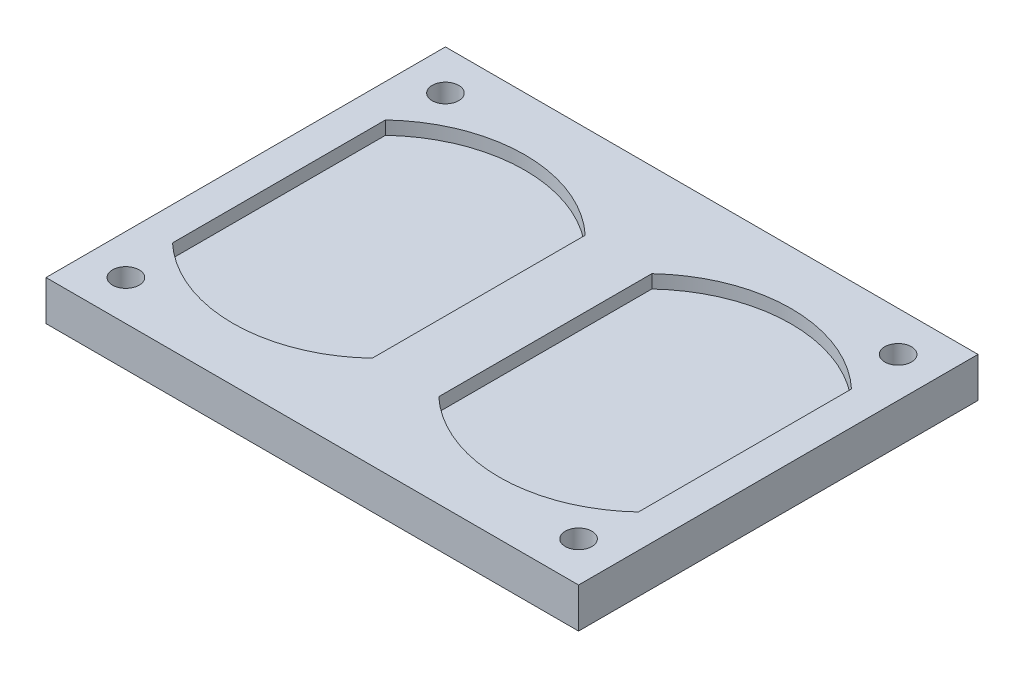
SolidWorks part; units mm, degrees
ref_plane "Front Plane" through (0, 0, 0) normal (0, 0, 1) x (1, 0, 0)
ref_plane "Top Plane" through (0, 0, 0) normal (0, 1, 0) x (1, 0, 0)
ref_plane "Right Plane" through (0, 0, 0) normal (1, 0, 0) x (0, 0, -1)
sketch "Sketch1" plane through (0, 0, 0) normal (0, 1, 0) x (1, 0, 0)
  line L1 (-100, -75) -> (100, -75)
  line L2 (-100, -75) -> (-100, 75)
  line L3 (-100, 75) -> (100, 75)
  line L4 (100, -75) -> (100, 75)
  line L5 (-100, -75) -> (100, 75) construction
  line L6 (-100, 75) -> (100, -75) construction
  point P0 (0, 0)
  dimension "D1" = 200
  dimension "D2" = 150
extrude "Boss-Extrude1" add sketch "Sketch1" along normal blind 15
sketch "Sketch2" plane through (0, 15, 0) normal (0, 1, 0) x (1, 0, 0)
  line L0 (0, -75) -> (0, 75) construction
  line L1 (-100, -75) -> (100, -75) construction
  line L2 (100, 75) -> (-100, 75) construction
  line L3 (0, 0) -> (-100, 0) construction
  line L4 (-100, 75) -> (-100, -75) construction
  line L5 (12.5, -40) -> (12.5, 40)
  line L7 (-87.5, -40) -> (-87.5, 40)
  line L9 (-12.5, -40) -> (-12.5, 40)
  line L10 (-87.5, -40) -> (-12.5, 40) construction
  line L11 (-87.5, 40) -> (-12.5, -40) construction
  line L12 (87.5, -40) -> (87.5, 40)
  arc A0 (-87.5, 40) -> (-12.5, 40) centre (-50, 0) cw
  arc A1 (-12.5, -40) -> (-87.5, -40) centre (-50, 0) cw
  arc A2 (12.5, -40) -> (87.5, -40) centre (50, 0) ccw
  arc A3 (87.5, 40) -> (12.5, 40) centre (50, 0) ccw
  point P10 (-50, 0)
  dimension "D1" = 80
  dimension "D2" = 75
extrude "Cut-Extrude1" cut sketch "Sketch2" against normal blind 5
hole_wizard "Ø10.0 (10) Diameter Hole1" positions "Sketch3" profile "Sketch4" hole size "Ø10.0" standard "ANSI Metric"
sketch "Sketch3" plane through (0, 15, 0) normal (0, 1, 0) x (1, 0, 0)
  line L0 (-100, -75) -> (100, -75) construction
  line L1 (100, 75) -> (-100, 75) construction
  line L2 (-100, 75) -> (-100, -75) construction
  line L3 (100, -75) -> (100, 75) construction
  point P0 (-85, 60)
  point P2 (85, 60)
  point P4 (85, -60)
  point P6 (-85, -60)
  dimension "D1" = 15
  dimension "D2" = 15
  dimension "D3" = 15
  dimension "D4" = 15
  dimension "D5" = 15
  dimension "D6" = 15
  dimension "D7" = 15
  dimension "D8" = 15
sketch "Sketch4" plane through (-85, 15, -60) normal (1, 0, 0) x (0, 0, 1)
  line L0 (0, 0) -> (0, 15)
  line L1 (0, 15) -> (5, 15)
  line L2 (5, 15) -> (5, 0)
  line L5 (5, 0) -> (0, 0)
  line L11 (0, -6.35) -> (0, 107.95) construction
  dimension "Thru Hole Dia." = 10
  dimension "Thru Hole Depth" = 15
